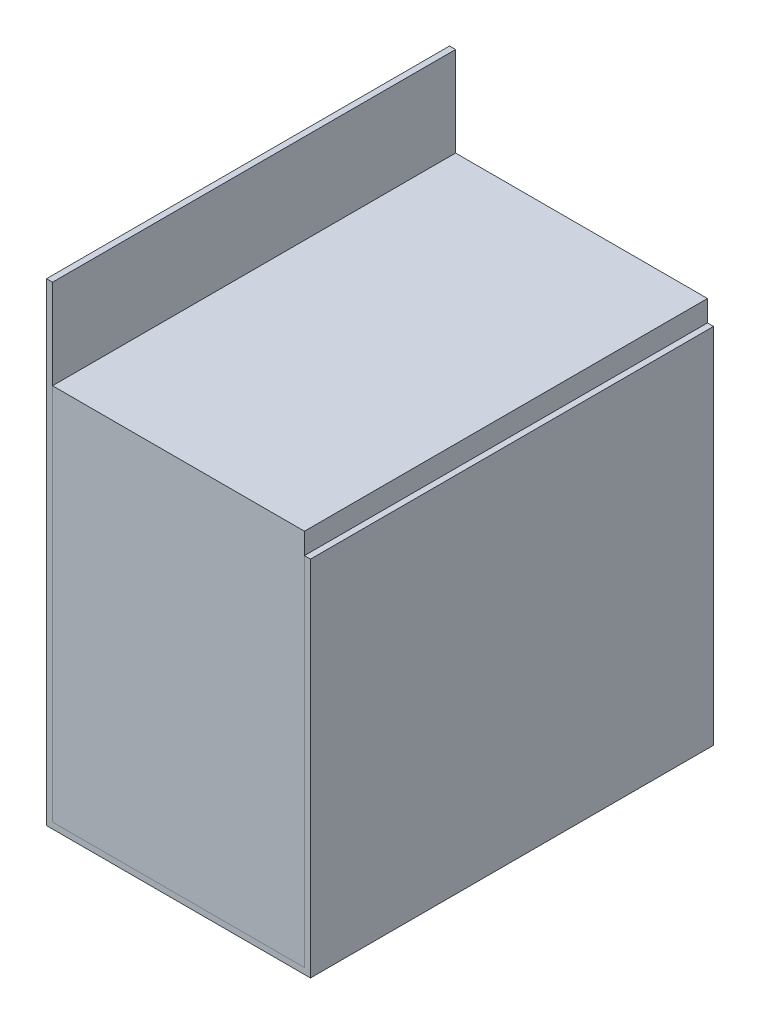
SolidWorks part; units mm, degrees
ref_plane "Front Plane" through (0, 0, 0) normal (0, 0, 1) x (1, 0, 0)
ref_plane "Top Plane" through (0, 0, 0) normal (0, 1, 0) x (1, 0, 0)
ref_plane "Right Plane" through (0, 0, 0) normal (1, 0, 0) x (0, 0, -1)
sketch "Esquisse1" plane through (0, 0, 0) normal (0, 0, 1) x (1, 0, 0)
  line L0 (0, -470) -> (262, -470)
  line L1 (0, 0) -> (6, 0)
  line L2 (0, 0) -> (0, -470)
  line L3 (262, -470) -> (262, -110)
  line L4 (6, 0) -> (6, -464)
  line L6 (256, -464) -> (6, -464)
  line L7 (262, -110) -> (256, -110)
  line L8 (256, -110) -> (256, -464)
  dimension "D1" = 6
  dimension "D2" = 470
  dimension "D3" = 360
  dimension "D4" = 250
extrude "Boss.-Extru.1" add sketch "Esquisse1" along normal mid plane 400
sketch "Esquisse2" plane through (0, 0, 0) normal (0, 0, 1) x (1, 0, 0)
  line L1 (6, -464) -> (256, -464)
  line L2 (6, -464) -> (6, -89)
  line L3 (6, -89) -> (256, -89)
  line L4 (256, -464) -> (256, -89)
  line L6 (256, -110) -> (256, -464) construction
  dimension "D1" = 375
extrude "Boss.-Extru.2" add sketch "Esquisse2" along normal mid plane 400 separate body
